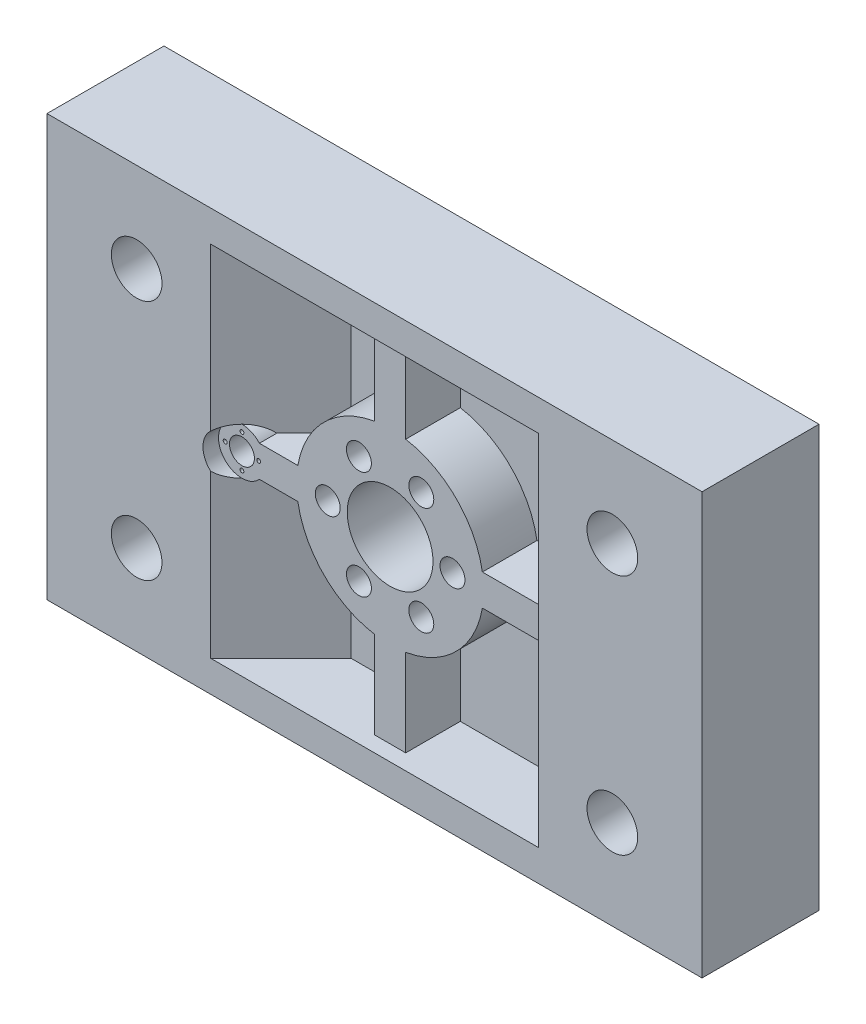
SolidWorks part; units mm, degrees
ref_plane "前视基准面" through (0, 0, 0) normal (0, 0, 1) x (1, 0, 0)
ref_plane "上视基准面" through (0, 0, 0) normal (0, 1, 0) x (1, 0, 0)
ref_plane "右视基准面" through (0, 0, 0) normal (1, 0, 0) x (0, 0, -1)
sketch "草图1" plane through (0, 0, 0) normal (0, 0, 1) x (1, 0, 0)
  line L0 (0, 0) -> (-190, 0) construction
  line L1 (420, 270) -> (-420, 270)
  line L2 (420, 270) -> (420, -270)
  line L3 (420, -270) -> (-420, -270)
  line L4 (-420, 270) -> (-420, -270)
  line L5 (420, 270) -> (-420, -270) construction
  line L6 (420, -270) -> (-420, 270) construction
  line L7 (-190, 0) -> (-211.5, 0) construction
  line L8 (-190, 0) -> (-190, -21.5) construction
  line L9 (0, 0) -> (80, 0) construction
  line L10 (0, 0) -> (0, -155) construction
  line L11 (0, -155) -> (305, -155) construction
  circle A0 centre (0, 0) radius 55
  circle A1 centre (-190, 0) radius 16
  circle A2 centre (-211.5, 0) radius 2.5
  circle A3 centre (-190, -21.5) radius 2.5
  circle A4 centre (-190, 21.5) radius 2.5
  circle A5 centre (-168.5, 0) radius 2.5
  circle A6 centre (80, 0) radius 11
  circle A7 centre (40, -69.282) radius 11
  circle A8 centre (-40, -69.282) radius 11
  circle A9 centre (-80, 0) radius 11
  circle A10 centre (-40, 69.282) radius 11
  circle A11 centre (40, 69.282) radius 11
  circle A12 centre (305, -155) radius 32.5
  circle A13 centre (305, 155) radius 32.5
  circle A14 centre (-305, -155) radius 32.5
  circle A15 centre (-305, 155) radius 32.5
  point P0 (0, 0)
  point P32 (0, 0)
  dimension "D3" = 6
  dimension "D1" = 840
  dimension "D2" = 540
extrude "凸台-拉伸1" add sketch "草图1" along normal blind 150
sketch "草图2" plane through (0, 0, 0) normal (0, 0, -1) x (-1, 0, 0)
  line L0 (-305, -155) -> (-380, -155) construction
  line L1 (-380, -20) -> (-380, -230)
  line L2 (-380, -230) -> (-225, -230)
  line L3 (-225, -230) -> (-225, -20)
  line L4 (-225, -20) -> (-380, -20)
  line L5 (0, 0) -> (120.7161, 0) construction
  line L6 (0, 0) -> (0, -169.6482) construction
  line L7 (380, -230) -> (225, -230)
  line L8 (225, -230) -> (225, -20)
  line L9 (380, -20) -> (380, -230)
  line L10 (225, -20) -> (380, -20)
  line L11 (380, 230) -> (225, 230)
  line L12 (380, 20) -> (380, 230)
  line L13 (225, 230) -> (225, 20)
  line L14 (225, 20) -> (380, 20)
  line L15 (-380, 230) -> (-225, 230)
  line L16 (-225, 230) -> (-225, 20)
  line L17 (-380, 20) -> (-380, 230)
  line L18 (-225, 20) -> (-380, 20)
extrude "切除-拉伸1" cut sketch "草图2" against normal blind 90
sketch "草图3" plane through (0, 230, 0) normal (0, -1, 0) x (1, 0, 0)
  line L0 (-380, 0) -> (-225, 0) construction
  line L1 (-225, 90) -> (-225, 0) construction
  line L2 (225, 90) -> (225, 0) construction
  line L3 (225, 0) -> (380, 0) construction
  line L4 (-225, 0) -> (-135, 0)
  line L5 (-225, 90) -> (-225, 0)
  line L6 (225, 90) -> (225, 0)
  line L7 (135, 0) -> (225, 0)
  line L8 (225, 90) -> (135, 0)
  line L9 (-225, 90) -> (-135, 0)
extrude "切除-拉伸2" cut sketch "草图3" along normal up to surface (210 mm away)
sketch "草图4" plane through (0, -230, 0) normal (0, 1, 0) x (1, 0, 0)
  line L0 (-135, 0) -> (-225, -90) construction
  line L1 (-380, 0) -> (-135, 0) construction
  line L2 (135, 0) -> (380, 0) construction
  line L3 (225, -90) -> (135, 0) construction
  line L4 (-225, -90) -> (-225, 0) construction
  line L5 (225, -90) -> (225, 0) construction
  line L6 (-135, 0) -> (-225, -90)
  line L7 (-225, 0) -> (-135, 0)
  line L8 (135, 0) -> (225, 0)
  line L9 (225, -90) -> (135, 0)
  line L10 (-225, -90) -> (-225, 0)
  line L11 (225, -90) -> (225, 0)
extrude "切除-拉伸3" cut sketch "草图4" along normal up to surface (210 mm away)
sketch "草图5" plane through (0, 0, 0) normal (0, 0, -1) x (-1, 0, 0)
  line L0 (380, -20) -> (192, -20) construction
  line L1 (135, -20) -> (188, -20) construction
  line L2 (188, 20) -> (135, 20) construction
  line L3 (192, 20) -> (380, 20) construction
  line L4 (212.3607, -20) -> (192, -20)
  line L5 (167.6393, -20) -> (188, -20)
  line L6 (188, 20) -> (167.6393, 20)
  line L7 (192, 20) -> (212.3607, 20)
  arc A0 (212.3607, 20) -> (167.6393, 20) centre (190, 0) ccw
  circle A1 centre (190, -21.5) radius 2.5 construction
  circle A2 centre (190, 21.5) radius 2.5 construction
  circle A3 centre (190, -21.5) radius 2.5
  circle A4 centre (190, 21.5) radius 2.5
  arc A5 (167.6393, -20) -> (212.3607, -20) centre (190, 0) ccw
extrude "凸台-拉伸2" add sketch "草图5" against normal up to surface (53 mm away) contours A5 A3 M11 M7 | A4 A0 M29 M31
sketch "草图6" plane through (0, 0, 150) normal (0, 0, 1) x (1, 0, 0)
  line L1 (120, 230) -> (-120, 230)
  line L2 (120, 230) -> (120, -230)
  line L3 (120, -230) -> (-120, -230)
  line L4 (-120, 230) -> (-120, -230)
  line L5 (120, 230) -> (-120, -230) construction
  line L6 (120, -230) -> (-120, 230) construction
  point P0 (0, 0)
  dimension "D1" = 240
  dimension "D2" = 460
extrude "切除-拉伸4" cut sketch "草图6" against normal blind 90
sketch "草图7" plane through (0, 230, 0) normal (0, -1, 0) x (1, 0, 0)
  line L0 (120, 60) -> (120, 150) construction
  line L1 (-120, 60) -> (-120, 150) construction
  line L2 (120, 150) -> (-120, 150) construction
  line L3 (120, 60) -> (120, 150)
  line L4 (-120, 60) -> (-120, 150)
  line L5 (210, 150) -> (120, 150)
  line L6 (120, 60) -> (210, 150)
  line L7 (-120, 60) -> (-210, 150)
  line L8 (-120, 150) -> (-210, 150)
extrude "切除-拉伸5" cut sketch "草图7" along normal up to surface (460 mm away)
sketch "草图8" plane through (0, 0, 150) normal (0, 0, 1) x (1, 0, 0)
  circle A2 centre (-190, 0) radius 30
extrude "切除-拉伸6" cut sketch "草图8" against normal blind 20
sketch "草图9" plane through (0, 0, 130) normal (0, 0, 1) x (1, 0, 0)
  line L0 (-190, 19) -> (-190, 16) construction
  line L1 (-190, -16) -> (-190, -19) construction
  line L2 (-190, -24) -> (-190, -30) construction
  line L3 (-190, 30) -> (-190, 24) construction
  line L4 (-190, 19) -> (-190, 16)
  line L5 (-190, -16) -> (-190, -19)
  line L6 (-190, -24) -> (-190, -30)
  line L7 (-190, 30) -> (-190, 24)
  circle A0 centre (-168.5, 0) radius 2.5 construction
  circle A1 centre (-190, 0) radius 16 construction
  circle A2 centre (-168.5, 0) radius 2.5
  arc A3 (-190, -16) -> (-190, 16) centre (-190, 0) ccw
  arc A4 (-190, -30) -> (-190, 30) centre (-190, 0) ccw
  circle A5 centre (-190, -21.5) radius 2.5 construction
  circle A6 centre (-190, 21.5) radius 2.5 construction
  arc A7 (-190, -24) -> (-190, -19) centre (-190, -21.5) ccw
  arc A8 (-190, 19) -> (-190, 24) centre (-190, 21.5) ccw
extrude "凸台-拉伸3" add sketch "草图9" against normal up to next
sketch "草图10" plane through (0, 0, 60) normal (0, 0, 1) x (1, 0, 0)
  line L0 (210, 230) -> (-210, 230) construction
  line L1 (-20, -118.3216) -> (-20, -230)
  line L2 (20, 230) -> (20, 118.3216)
  line L3 (20, -118.3216) -> (20, -230)
  line L4 (-20, 230) -> (-20, 118.3216)
  line L5 (20, 367.0698) -> (-20, -367.0698) construction
  line L6 (20, -367.0698) -> (-20, 367.0698) construction
  line L7 (-210, -230) -> (210, -230) construction
  line L8 (20, 230) -> (-20, 230)
  line L9 (-20, -230) -> (20, -230)
  arc A0 (20, -118.3216) -> (20, 118.3216) centre (0, 0) ccw
  circle A1 centre (80, 0) radius 11 construction
  circle A2 centre (40, -69.282) radius 11 construction
  circle A3 centre (-40, -69.282) radius 11 construction
  circle A4 centre (-80, 0) radius 11 construction
  circle A5 centre (40, 69.282) radius 11 construction
  circle A6 centre (-40, 69.282) radius 11 construction
  circle A7 centre (0, 0) radius 55 construction
  circle A8 centre (80, 0) radius 11
  circle A9 centre (40, -69.282) radius 11
  circle A10 centre (-40, -69.282) radius 11
  circle A11 centre (-80, 0) radius 11
  circle A12 centre (40, 69.282) radius 11
  circle A13 centre (-40, 69.282) radius 11
  circle A14 centre (0, 0) radius 55
  arc A15 (-20, 118.3216) -> (-20, -118.3216) centre (0, 0) ccw
  dimension "D1" = 40
extrude "凸台-拉伸4" add sketch "草图10" along normal blind 70
sketch "草图11" plane through (0, 0, 130) normal (0, 0, 1) x (1, 0, 0)
  circle A0 centre (-40, 69.282) radius 16
  circle A1 centre (40, 69.282) radius 16
  circle A2 centre (80, 0) radius 16
  circle A3 centre (-80, 0) radius 16
  circle A4 centre (-40, -69.282) radius 16
  circle A5 centre (40, -69.282) radius 16
extrude "切除-拉伸7" cut sketch "草图11" against normal blind 25
sketch "草图12" plane through (0, 0, 130) normal (0, 0, 1) x (1, 0, 0)
  line L1 (210, 20) -> (118.3216, 20)
  line L2 (-118.3216, -20) -> (-167.6393, -20)
  line L3 (210, -20) -> (118.3216, -20)
  line L4 (-118.3216, 20) -> (-167.6393, 20)
  line L5 (259.1643, 20) -> (-259.1643, -20) construction
  line L6 (259.1643, -20) -> (-259.1643, 20) construction
  line L7 (210, -230) -> (210, 230) construction
  line L9 (210, -230) -> (210, 230)
  arc A0 (-20, 118.3216) -> (-20, -118.3216) centre (0, 0) ccw construction
  arc A1 (20, -118.3216) -> (20, 118.3216) centre (0, 0) ccw construction
  arc A2 (-118.3216, 20) -> (-118.3216, -20) centre (0, 0) ccw
  arc A3 (118.3216, -20) -> (118.3216, 20) centre (0, 0) ccw
  arc A4 (-190, -30) -> (-190, 30) centre (-190, 0) ccw construction
  arc A5 (-167.6393, -20) -> (-167.6393, 20) centre (-190, 0) ccw
  point P0 (0, 0)
  dimension "D1" = 40
extrude "凸台-拉伸5" add sketch "草图12" against normal up to next contours A5 L2 L4 M12 | L3 L9 L1 M8
